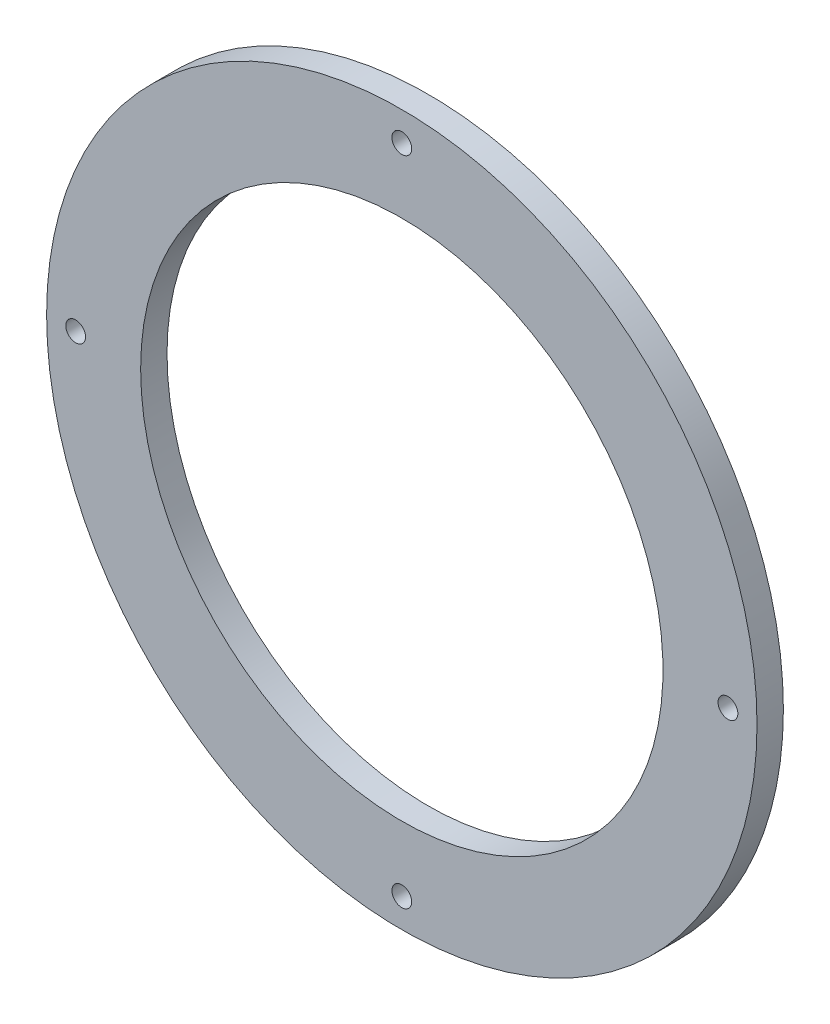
SolidWorks part; units mm, degrees
ref_plane "Front Plane" through (0, 0, 0) normal (0, 0, 1) x (1, 0, 0)
ref_plane "Top Plane" through (0, 0, 0) normal (0, 1, 0) x (1, 0, 0)
ref_plane "Right Plane" through (0, 0, 0) normal (1, 0, 0) x (0, 0, -1)
sketch "Sketch1" plane through (0, 0, 0) normal (0, 0, 1) x (1, 0, 0)
  line L0 (0, 78.5) -> (0, 0) construction
  line L7 (78.5, 0) -> (0, 0) construction
  circle A0 centre (0, 0) radius 85.5
  circle A1 centre (0, 78.5) radius 2.3813
  circle A2 centre (78.5, 0) radius 2.3813
  circle A3 centre (0, -78.5) radius 2.3813
  circle A4 centre (-78.5, 0) radius 2.3813
  point P18 (0, 0)
  dimension "D1" = 171
  dimension "D4" = 4.7625
  dimension "D7" = 78.5
  dimension "D5" = 78.5
  dimension "D6" = 4
extrude "Boss-Extrude1" add sketch "Sketch1" along normal blind 6.35
sketch "Sketch2" plane through (0, 0, 0) normal (0, 0, -1) x (-1, 0, 0)
  line L1 (34.925, 57.15) -> (-34.925, 57.15)
  line L2 (34.925, 57.15) -> (34.925, -57.15)
  line L3 (34.925, -57.15) -> (-34.925, -57.15)
  line L4 (-34.925, 57.15) -> (-34.925, -57.15)
  line L5 (34.925, 57.15) -> (-34.925, -57.15) construction
  line L6 (34.925, -57.15) -> (-34.925, 57.15) construction
  point P0 (0, 0)
  dimension "D1" = 69.85
  dimension "D2" = 114.3
extrude "Cut-Extrude1" [suppressed] cut sketch "Sketch2" against normal through all
sketch "Sketch3" plane through (0, 0, 0) normal (0, 0, -1) x (-1, 0, 0)
  line L1 (27.813, 57.15) -> (-27.813, 57.15)
  line L2 (27.813, 57.15) -> (27.813, -57.15)
  line L3 (27.813, -57.15) -> (-27.813, -57.15)
  line L4 (-27.813, 57.15) -> (-27.813, -57.15)
  line L5 (27.813, 57.15) -> (-27.813, -57.15) construction
  line L6 (27.813, -57.15) -> (-27.813, 57.15) construction
  point P0 (0, 0)
  dimension "D1" = 114.3
  dimension "D2" = 55.626
extrude "Cut-Extrude2" [suppressed] cut sketch "Sketch3" against normal through all
sketch "Sketch4" plane through (0, 0, 0) normal (0, 0, 1) x (1, 0, 0)
  line L0 (-10.5753, 63.3127) -> (10.5753, 63.3127)
  line L1 (23.9337, 20.087) -> (5.5609, 6.2059)
  line L2 (0, -60.1313) -> (0, 63.3127) construction
  line L3 (-35.2806, 44.2107) -> (35.2806, 44.2107) construction
  line L4 (-34.9321, -41.8368) -> (-1.0296, -41.8368) construction
  line L5 (3.822, 0.3425) -> (4.8401, -0.9039)
  line L6 (4.8401, -0.9039) -> (6.2041, -2.103)
  line L7 (6.2041, -2.103) -> (9.1763, -4.1225)
  line L8 (5.5221, -63.3127) -> (-5.5221, -63.3127)
  line L9 (0, -63.3127) -> (0, 63.3127) construction
  line L10 (0, 63.3127) -> (0, -63.3127)
  line L11 (0, -85.5) -> (0, 85.5) construction
  line L12 (-85.4999, 0.1573) -> (85.4999, 0.1573) construction
  line L13 (-6.2041, -2.103) -> (-9.1763, -4.1225)
  line L14 (-4.8401, -0.9039) -> (-6.2041, -2.103)
  line L15 (-3.822, 0.3425) -> (-4.8401, -0.9039)
  line L16 (-23.9337, 20.087) -> (-5.5609, 6.2059)
  line L17 (3.2692, 2.4584) -> (-3.2692, 2.4584) construction
  arc A0 (10.5753, 63.3127) -> (25.7679, 58.999) centre (10.5753, 34.4019) cw
  arc A1 (25.7679, 58.999) -> (35.2806, 44.2107) centre (15.0545, 41.6538) cw
  arc A2 (35.2806, 44.2107) -> (34.1036, 36.011) centre (19.7808, 42.2513) cw
  arc A3 (34.1036, 36.011) -> (23.9337, 20.087) centre (-21.1263, 60.0741) cw
  arc A4 (5.5609, 6.2059) -> (3.2692, 2.4584) centre (9.1763, 1.4206) ccw
  arc A5 (3.2692, 2.4584) -> (3.822, 0.3425) centre (5.8559, 2.004) ccw
  arc A6 (9.1763, -4.1225) -> (18.5651, -11.0062) centre (-82.1114, -138.4749) cw
  arc A7 (18.5651, -11.0062) -> (31.7982, -26.1892) centre (-15.2929, -53.8745) cw
  arc A8 (31.7982, -26.1892) -> (34.6396, -36.6286) centre (14.0414, -36.6286) cw
  arc A9 (34.6396, -36.6286) -> (27.3698, -53.8745) centre (10.5487, -36.6286) cw
  arc A10 (27.3698, -53.8745) -> (20.287, -58.8608) centre (8.3322, -34.356) cw
  arc A11 (20.287, -58.8608) -> (5.5221, -63.3127) centre (-0.7981, -15.6409) cw
  circle A12 centre (0, 0) radius 85.5 construction
  arc A13 (-20.287, -58.8608) -> (-5.5221, -63.3127) centre (0.7981, -15.6409) ccw
  arc A14 (-27.3698, -53.8745) -> (-20.287, -58.8608) centre (-8.3322, -34.356) ccw
  arc A15 (-34.6396, -36.6286) -> (-27.3698, -53.8745) centre (-10.5487, -36.6286) ccw
  arc A16 (-31.7982, -26.1892) -> (-34.6396, -36.6286) centre (-14.0414, -36.6286) ccw
  arc A17 (-18.5651, -11.0062) -> (-31.7982, -26.1892) centre (15.2929, -53.8745) ccw
  arc A18 (-9.1763, -4.1225) -> (-18.5651, -11.0062) centre (82.1114, -138.4749) ccw
  arc A19 (-3.2692, 2.4584) -> (-3.822, 0.3425) centre (-5.8559, 2.004) cw
  arc A20 (-5.5609, 6.2059) -> (-3.2692, 2.4584) centre (-9.1763, 1.4206) cw
  arc A21 (-34.1036, 36.011) -> (-23.9337, 20.087) centre (21.1263, 60.0741) ccw
  arc A22 (-35.2806, 44.2107) -> (-34.1036, 36.011) centre (-19.7808, 42.2513) ccw
  arc A23 (-25.7679, 58.999) -> (-35.2806, 44.2107) centre (-15.0545, 41.6538) ccw
  arc A24 (-10.5753, 63.3127) -> (-25.7679, 58.999) centre (-10.5753, 34.4019) ccw
  point P44 (0, 0)
  dimension "D1" = 35.2806
  dimension "D2" = 123.444
  dimension "D3" = 2.3011
sketch "Sketch6" plane through (0, 0, 0) normal (0, 0, -1) x (-1, 0, 0)
  circle A0 centre (0, 0) radius 62.865
  dimension "D1" = 125.73
extrude "Cut-Extrude3" cut sketch "Sketch6" against normal through all
sketch "Sketch7" [suppressed] plane through (0, 0, 0) normal (0, 0, -1) x (-1, 0, 0)
  circle A0 centre (0, 0) radius 62.865
  dimension "D1" = 125.73
extrude "Cut-Extrude4" [suppressed] cut sketch "Sketch7" against normal through all
